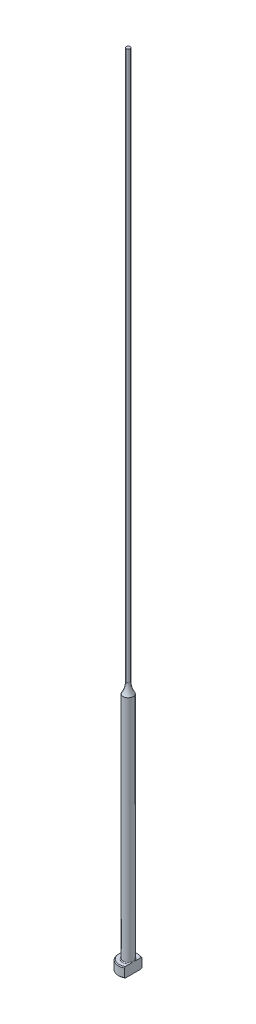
SolidWorks part; units mm, degrees
ref_plane "Front Plane" through (0, 0, 0) normal (0, 0, 1) x (1, 0, 0)
ref_plane "Top Plane" through (0, 0, 0) normal (0, 1, 0) x (1, 0, 0)
ref_plane "Right Plane" through (0, 0, 0) normal (1, 0, 0) x (0, 0, -1)
sketch "Sketch1" plane through (0, 0, 0) normal (0, 0, 1) x (1, 0, 0)
  line L0 (0, 259.9588) -> (0, -15.1925) construction
  line L1 (0, 0) -> (-3.175, 0)
  line L2 (-3.175, 0) -> (-3.175, 3.175)
  line L3 (-3.175, 3.175) -> (-1.5875, 3.175)
  line L4 (-0.5944, 79.6098) -> (-0.5944, 254)
  line L5 (-0.5944, 254) -> (0, 254)
  line L6 (0, 254) -> (0, 0)
  line L7 (-1.5875, 3.175) -> (-1.5875, 76.2)
  arc A0 (-1.5875, 76.2) -> (-0.5944, 79.6098) centre (-6.9444, 79.6098) ccw
  point P13 (-1.5875, 0)
  dimension "D1" = 6.35
  dimension "L" = 254
  dimension "D2" = 3.175
  dimension "H" = 6.35
  dimension "T" = 3.175
  dimension "D" = 1.1887
  dimension "S" = 76.2
revolve "Revolve1" add sketch "Sketch1" angle 360 about L0
chamfer "Chamfer1" distance 0.254 angle 45 2 edges at (0, 3.175, 3.175) (0, 0, 3.175)
fillet "Fillet1" radius 0.254 1 edges at (0, 3.175, 1.5875)
sketch "Sketch2" plane through (0, 0, 0) normal (0, 1, 0) x (1, 0, 0)
  line L0 (1.5875, -2.7496) -> (1.5875, 2.7496)
  circle A0 centre (0, 0) radius 3.175 construction
  arc A2 (1.5875, -2.7496) -> (1.5875, 2.7496) centre (0, 0) ccw
  circle A3 centre (0, 0) radius 3.175 construction
  circle A4 centre (0, 0) radius 1.5875 construction
extrude "Key Head" cut sketch "Sketch2" along normal up to next
